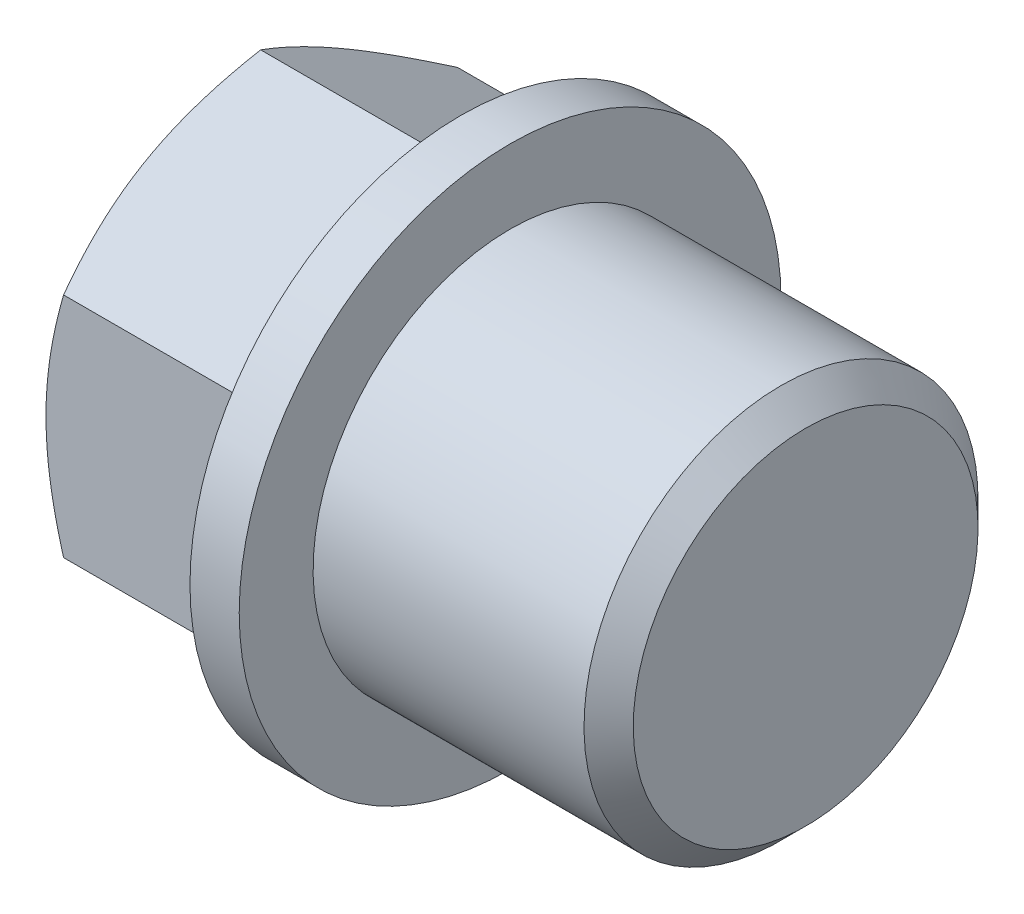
SolidWorks part; units mm, degrees
ref_plane "Спереди" through (0, 0, 0) normal (0, 0, 1) x (1, 0, 0)
ref_plane "Сверху" through (0, 0, 0) normal (0, 1, 0) x (1, 0, 0)
ref_plane "Справа" through (0, 0, 0) normal (1, 0, 0) x (0, 0, -1)
sketch "Sketch1" plane through (0, 0, 0) normal (0, 0, 1) x (1, 0, 0)
  line L0 (60.8173, 0) -> (-12.8173, 0) construction
  line L1 (0, 0) -> (0, 9.2376)
  line L2 (0, 9.2376) -> (10, 9.2376)
  line L3 (10, 9.2376) -> (10, 11)
  line L4 (10, 11) -> (12, 11)
  line L5 (12, 11) -> (12, 8)
  line L6 (12, 8) -> (24, 8)
  line L7 (24, 8) -> (24, 0)
  line L8 (24, 0) -> (0, 0)
  dimension "D1" = 16
  dimension "D2" = 12
  dimension "D3" = 2
  dimension "D4" = 24
  dimension "D5" = 22
  dimension "D6" = 18.4752
revolve "Revolve1" add sketch "Sketch1" angle 360 about L0
sketch "Sketch2" plane through (0, 0, 0) normal (-1, 0, 0) x (0, 0, 1)
  line L0 (0, 16.37) -> (0, -15.4873) construction
  line L1 (18.7773, 0) -> (-15.9687, 0) construction
  line L2 (0, 9.2376) -> (-8, 4.6188)
  line L3 (-8, 4.6188) -> (-8, -4.6188)
  line L4 (-8, -4.6188) -> (0, -9.2376)
  line L5 (8, -4.6188) -> (0, -9.2376)
  line L6 (8, 4.6188) -> (8, -4.6188)
  line L7 (0, 9.2376) -> (8, 4.6188)
  circle A0 centre (0, 0) radius 9.2376 construction
  circle A1 centre (0, 0) radius 9.2376 construction
extrude "Cut-Extrude1" cut sketch "Sketch2" against normal blind 10 flip side to cut
chamfer "Chamfer1" distance 1 angle 45 1 edges at (24, 8, 0)
sketch "Sketch3" plane through (0, 0, 0) normal (0, 0, 1) x (1, 0, 0)
  line L0 (0, 10.5) -> (0, 6)
  line L1 (0, 4.6188) -> (0, 9.2376) construction
  line L2 (0, 6) -> (2.5981, 10.5)
  line L3 (2.5981, 10.5) -> (0, 10.5)
  line L4 (-1.9724, 0) -> (26.0926, 0) construction
  dimension "D1" = 21
  dimension "D2" = 30
  dimension "D3" = 12
revolve "Cut-Revolve1" cut sketch "Sketch3" angle 360 about L4
